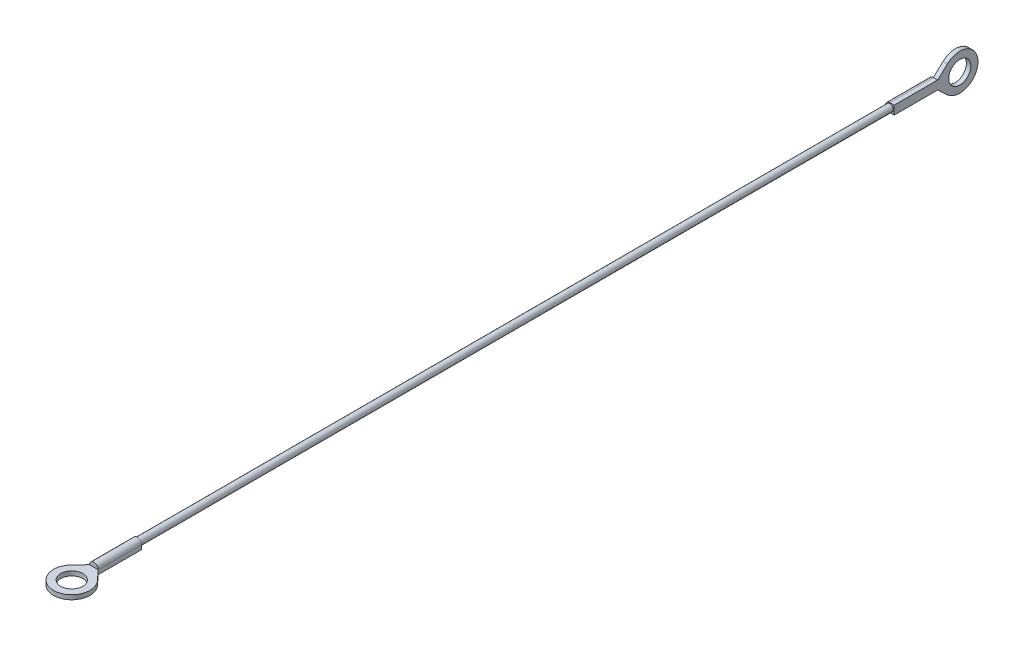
SolidWorks part; units mm, degrees
ref_plane "Front Plane" through (0, 0, 0) normal (0, 0, 1) x (1, 0, 0)
ref_plane "Top Plane" through (0, 0, 0) normal (0, 1, 0) x (1, 0, 0)
ref_plane "Right Plane" through (0, 0, 0) normal (1, 0, 0) x (0, 0, -1)
sketch "Sketch1" plane through (0, 0, 0) normal (0, 0, 1) x (1, 0, 0)
  circle A0 centre (0, 0) radius 0.795
extrude "Boss-Extrude1" add sketch "Sketch1" along normal mid plane 173.04
sketch "Sketch2" plane through (0, 0, 86.52) normal (0, 0, 1) x (1, 0, 0)
  line L0 (-0.995, 0) -> (-0.995, -0.995)
  line L1 (-0.995, -0.995) -> (0, -0.995)
  line L2 (0, -0.995) -> (0.995, -0.995)
  line L3 (0.995, -0.995) -> (0.995, 0)
  arc A0 (0.995, 0) -> (-0.995, 0) centre (0, 0) ccw
  dimension "D1" = 1.99
extrude "Boss-Extrude2" add sketch "Sketch2" along normal blind 10
sketch "Sketch3" plane through (0, -0.995, 0) normal (0, -1, 0) x (1, 0, 0)
  line L0 (0.995, 96.52) -> (3.0665, 98.7447)
  line L1 (-3.0665, 98.7447) -> (-0.995, 96.52)
  line L2 (-0.995, 96.52) -> (0.995, 96.52)
  arc A0 (3.0665, 98.7447) -> (-3.0665, 98.7447) centre (0, 101.6) ccw
  circle A1 centre (0, 101.6) radius 2.54
  point P8 (4.19, 101.6)
  point P9 (-4.19, 101.6)
  dimension "D1" = 5.08
  dimension "D2" = 8.38
  dimension "D3" = 101.6
extrude "Boss-Extrude3" add sketch "Sketch3" against normal blind 1.01
sketch "Sketch4" plane through (0, 0, -86.52) normal (0, 0, -1) x (-1, 0, 0)
  line L0 (0, 0.995) -> (-0.995, 0.995)
  line L1 (-0.995, 0.995) -> (-0.995, 0)
  line L2 (-0.995, 0) -> (-0.995, -0.995)
  line L3 (-0.995, -0.995) -> (0, -0.995)
  arc A0 (0, -0.995) -> (0, 0.995) centre (0, 0) ccw
  dimension "D1" = 1.99
extrude "Boss-Extrude4" add sketch "Sketch4" along normal blind 10
sketch "Sketch5" plane through (0.995, 0, 0) normal (1, 0, 0) x (0, 0, -1)
  line L0 (96.52, -0.995) -> (96.52, 0.995)
  line L1 (96.52, 0.995) -> (98.7447, 3.0665)
  line L2 (98.7447, -3.0665) -> (96.52, -0.995)
  arc A0 (98.7447, 3.0665) -> (98.7447, -3.0665) centre (101.6, 0) cw
  circle A1 centre (101.6, 0) radius 2.54
  point P8 (101.6, 4.19)
  point P9 (101.6, -4.19)
  dimension "D1" = 5.08
  dimension "D2" = 8.38
  dimension "D3" = 101.6
extrude "Boss-Extrude5" add sketch "Sketch5" against normal blind 1.01
